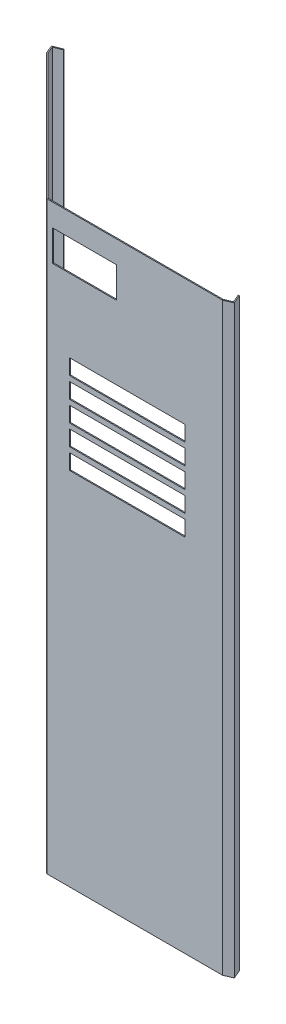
SolidWorks part; units mm, degrees
ref_plane "Plan de face" through (0, 0, 0) normal (0, 0, 1) x (1, 0, 0)
ref_plane "Plan de dessus" through (0, 0, 0) normal (0, 1, 0) x (1, 0, 0)
ref_plane "Plan de droite" through (0, 0, 0) normal (1, 0, 0) x (0, 0, -1)
sketch "Esquisse1" plane through (0, 0, 0) normal (0, 1, 0) x (1, 0, 0)
  line L0 (0, 0) -> (-685, 0)
  line L1 (-685, 0) -> (-1176.4392, 491.4392)
  line L2 (0, 0) -> (32.2177, 13.6756)
  line L3 (32.2177, 13.6756) -> (17.3699, 48.6548)
  line L4 (-1176.4392, 491.4392) -> (-1189.5504, 523.8906)
  line L5 (-1189.5504, 523.8906) -> (-1154.3175, 538.1257)
  dimension "D1" = 685
  dimension "D2" = 695
  dimension "D3" = 135
  dimension "D4" = 35
  dimension "D5" = 38
  dimension "D6" = 23
  dimension "D7" = 38
  dimension "D8" = 35
  dimension "D9" = 23
extrude "Extru.-Mince1" add sketch "Esquisse1" along normal blind 2276 thin
fillet "Congé1" radius 4 1 edges at (-685, 1138, 0)
fillet "Congé2" radius 2 1 edges at (-683.3431, 1138, -4)
sketch "Esquisse2" plane through (0, 0, 0) normal (0, 0, 1) x (1, 0, 0)
  line L0 (0, 2276) -> (0, 0) construction
  line L1 (-662, 2189) -> (-412, 2189)
  line L2 (-662, 2189) -> (-662, 2069)
  line L3 (-662, 2069) -> (-412, 2069)
  line L4 (-412, 2189) -> (-412, 2069)
  line L5 (0, 2276) -> (-683.3431, 2276) construction
  line L7 (-596, 1784) -> (-146, 1784)
  line L8 (-596, 1784) -> (-596, 1724)
  line L9 (-596, 1724) -> (-146, 1724)
  line L10 (-146, 1784) -> (-146, 1724)
  line L11 (-596, 1704) -> (-146, 1704)
  line L12 (-596, 1704) -> (-596, 1644)
  line L13 (-596, 1644) -> (-146, 1644)
  line L14 (-146, 1704) -> (-146, 1644)
  line L15 (-596, 1624) -> (-146, 1624)
  line L16 (-596, 1624) -> (-596, 1564)
  line L17 (-596, 1564) -> (-146, 1564)
  line L18 (-146, 1624) -> (-146, 1564)
  line L19 (-596, 1544) -> (-146, 1544)
  line L20 (-596, 1544) -> (-596, 1484)
  line L21 (-596, 1484) -> (-146, 1484)
  line L22 (-146, 1544) -> (-146, 1484)
  line L23 (-596, 1464) -> (-146, 1464)
  line L24 (-596, 1464) -> (-596, 1404)
  line L25 (-596, 1404) -> (-146, 1404)
  line L26 (-146, 1464) -> (-146, 1404)
  dimension "D1" = 250
  dimension "D2" = 120
  dimension "D3" = 412
  dimension "D4" = 87
  dimension "D5" = 450
  dimension "D6" = 146
  dimension "D7" = 60
  dimension "D8" = 492
  dimension "D9" = 80
  dimension "D10" = 160
  dimension "D11" = 240
  dimension "D12" = 320
extrude "Enlèv. mat.-Extru.1" cut sketch "Esquisse2" against normal through all
sketch "Esquisse3" plane through (-342.5, 0, 342.5) normal (-0.7071, 0, 0.7071) x (0.7071, 0, 0.7071)
  line L0 (-486.025, 2276) -> (-1179.3681, 2276) construction
  line L1 (-767.3681, 2189) -> (-517.3681, 2189)
  line L2 (-767.3681, 2189) -> (-767.3681, 2069)
  line L3 (-767.3681, 2069) -> (-517.3681, 2069)
  line L4 (-517.3681, 2189) -> (-517.3681, 2069)
  line L5 (-767.3681, 1869) -> (-517.3681, 1869)
  line L6 (-767.3681, 1869) -> (-767.3681, 1749)
  line L7 (-767.3681, 1749) -> (-517.3681, 1749)
  line L8 (-517.3681, 1869) -> (-517.3681, 1749)
  line L9 (-1097.3681, 1869) -> (-847.3681, 1869)
  line L10 (-1097.3681, 1869) -> (-1097.3681, 1749)
  line L11 (-1097.3681, 1749) -> (-847.3681, 1749)
  line L12 (-847.3681, 1869) -> (-847.3681, 1749)
  line L13 (-1097.3681, 1549) -> (-847.3681, 1549)
  line L14 (-1097.3681, 1549) -> (-1097.3681, 1429)
  line L15 (-1097.3681, 1429) -> (-847.3681, 1429)
  line L16 (-847.3681, 1549) -> (-847.3681, 1429)
  line L17 (-767.3681, 1549) -> (-517.3681, 1549)
  line L18 (-767.3681, 1549) -> (-767.3681, 1429)
  line L19 (-767.3681, 1429) -> (-517.3681, 1429)
  line L20 (-517.3681, 1549) -> (-517.3681, 1429)
  line L22 (-1179.3681, 2276) -> (-1179.3681, 0) construction
  dimension "D1" = 250
  dimension "D2" = 87
  dimension "D3" = 120
  dimension "D4" = 200
  dimension "D5" = 82
  dimension "D6" = 80
  dimension "D7" = 200
extrude "Enlèv. mat.-Extru.2" cut sketch "Esquisse3" against normal through all
